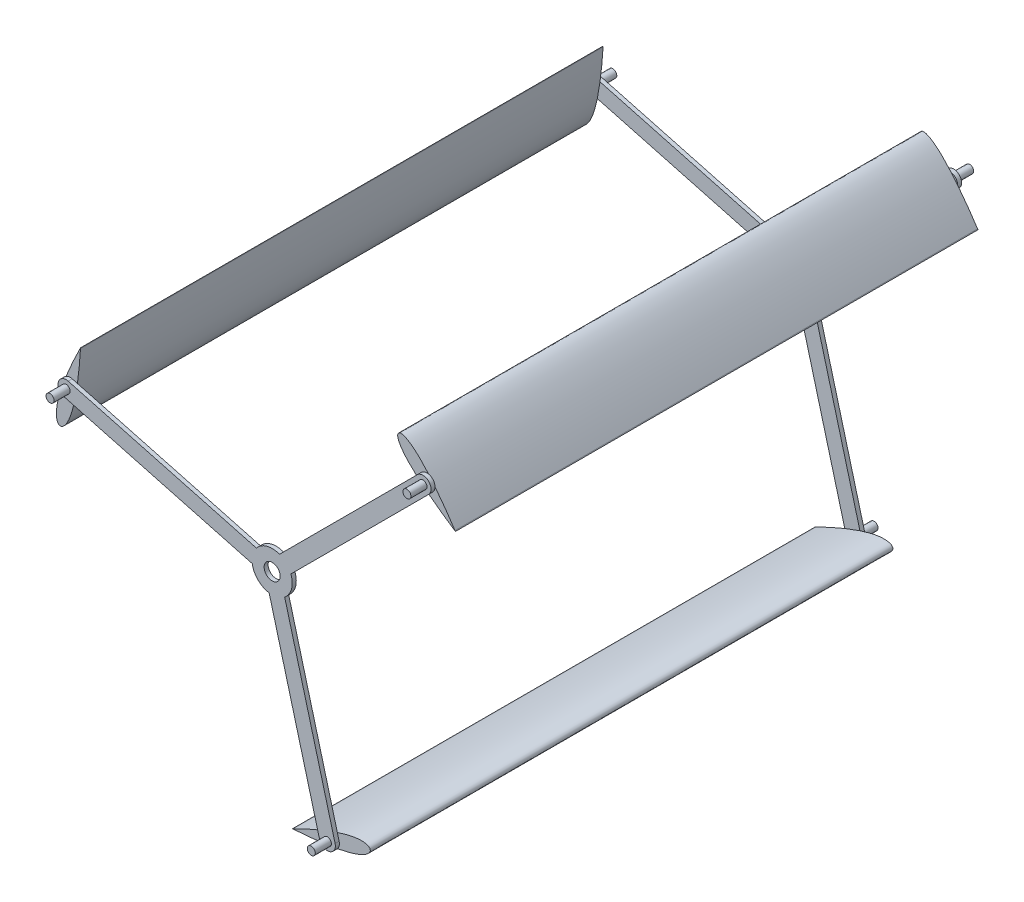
SolidWorks part; units mm, degrees
ref_plane "Front Plane" through (0, 0, 0) normal (0, 0, 1) x (1, 0, 0)
ref_plane "Top Plane" through (0, 0, 0) normal (0, 1, 0) x (1, 0, 0)
ref_plane "Right Plane" through (0, 0, 0) normal (1, 0, 0) x (0, 0, -1)
curve "Curve1"
sketch "Sketch2" plane through (0, 0, 0) normal (0, 0, 1) x (1, 0, 0)
  line L0 (222.4638, 153.0343) -> (222.972, 152.2613)
  line L1 (222.1989, 152.7695) -> (222.972, 152.2613)
  line L2 (222.972, 152.2613) -> (152.2613, 222.972) construction
  line L3 (152.2613, 222.972) -> (159.3324, 230.043) construction
  line L4 (0, 0) -> (270, 0) construction
  line L5 (21.2028, -268.8147) -> (20.3762, -269.23)
  line L6 (21.2997, -269.1765) -> (20.3762, -269.23)
  line L7 (-243.4017, 116.0452) -> (-243.3481, 116.9687)
  line L8 (-243.7635, 116.1421) -> (-243.3481, 116.9687)
  circle A0 centre (0, 0) radius 270 construction
  spline S0 degree 3 poles (21.2997, -269.1765) (22.9826, -269.0788) (26.3445, -268.8838) (33.0486, -268.397) (41.3962, -267.6661) (51.37, -266.5966) (61.2893, -265.33) (71.1454, -263.8269) (80.9209, -262.014) (88.9802, -260.141) (95.338, -258.3231) (100.0555, -256.7548) (104.7113, -254.9199) (108.5033, -253.083) (111.4474, -251.3179) (113.6355, -249.7453) (115.3778, -248.0908) (116.843, -246.0554) (117.487, -243.2093) (115.5062, -241.0664) (113.2197, -240.0364) (110.8835, -239.4746) (108.2023, -239.2068) (104.7701, -239.1502) (100.5676, -239.4554) (95.6182, -240.1942) (90.7485, -241.1948) (84.3336, -242.7994) (76.4175, -245.2069) (67.0452, -248.5247) (57.758, -252.151) (48.5343, -256.0138) (39.3621, -260.0744) (31.7673, -263.6153) (25.718, -266.5457) (22.709, -268.0578) (21.2028, -268.8147) knots 0 0 0 0 0.024604 0.049152 0.098109 0.146905 0.195555 0.244056 0.29241 0.340644 0.364754 0.388906 0.413178 0.437756 0.450305 0.46323 0.477068 0.485036 0.5 0.514964 0.522932 0.53677 0.549695 0.562244 0.586822 0.611094 0.635246 0.659356 0.70759 0.755944 0.804445 0.853095 0.901891 0.950848 0.975396 1 1 1 1
  spline S1 degree 3 poles (222.4638, 153.0343) (221.5378, 154.4429) (219.688, 157.2569) (215.9143, 162.8194) (211.1075, 169.6832) (205.1944, 177.786) (199.1378, 185.7431) (192.9081, 193.5272) (186.4503, 201.0866) (180.7986, 207.1296) (176.0454, 211.7266) (172.3284, 215.028) (168.4114, 218.1426) (164.9246, 220.5081) (161.924, 222.1752) (159.468, 223.2839) (157.164, 223.9655) (154.6688, 224.2167) (151.8819, 223.3513) (151.0166, 220.5645) (151.2678, 218.0693) (151.9494, 215.7652) (153.058, 213.3093) (154.7251, 210.3086) (157.0906, 206.8218) (160.2052, 202.9049) (163.5066, 199.1879) (168.1036, 194.4347) (174.1467, 188.783) (181.7061, 182.3252) (189.4902, 176.0954) (197.4473, 170.0388) (205.55, 164.1257) (212.4139, 159.3189) (217.9764, 155.5453) (220.7904, 153.6954) (222.1989, 152.7695) knots 0 0 0 0 0.024604 0.049152 0.098109 0.146905 0.195555 0.244056 0.29241 0.340644 0.364754 0.388906 0.413178 0.437756 0.450305 0.46323 0.477068 0.485036 0.5 0.514964 0.522932 0.53677 0.549695 0.562244 0.586822 0.611094 0.635246 0.659356 0.70759 0.755944 0.804445 0.853095 0.901891 0.950848 0.975396 1 1 1 1
  spline S2 degree 3 poles (-243.7635, 116.1421) (-244.5204, 114.6359) (-246.0325, 111.627) (-248.9629, 105.5776) (-252.5038, 97.9828) (-256.5644, 88.8106) (-260.4271, 79.5869) (-264.0535, 70.2997) (-267.3712, 60.9274) (-269.7788, 53.0113) (-271.3833, 46.5964) (-272.3839, 41.7267) (-273.1227, 36.7773) (-273.428, 32.5748) (-273.3714, 29.1426) (-273.1035, 26.4614) (-272.5418, 24.1252) (-271.5118, 21.8387) (-269.3689, 19.8579) (-266.5227, 20.5019) (-264.4874, 21.9671) (-262.8329, 23.7094) (-261.2603, 25.8975) (-259.4952, 28.8416) (-257.6583, 32.6336) (-255.8234, 37.2894) (-254.2551, 42.0069) (-252.4372, 48.3647) (-250.5642, 56.424) (-248.7513, 66.1995) (-247.2482, 76.0556) (-245.9816, 85.9749) (-244.9121, 95.9487) (-244.1812, 104.2963) (-243.6943, 111.0005) (-243.4993, 114.3623) (-243.4017, 116.0452) knots 0 0 0 0 0.024604 0.049152 0.098109 0.146905 0.195555 0.244056 0.29241 0.340644 0.364754 0.388906 0.413178 0.437756 0.450305 0.46323 0.477068 0.485036 0.5 0.514964 0.522932 0.53677 0.549695 0.562244 0.586822 0.611094 0.635246 0.659356 0.70759 0.755944 0.804445 0.853095 0.901891 0.950848 0.975396 1 1 1 1
  point P17 (0, 0)
  dimension "D3" = 540
  dimension "D1" = 100
  dimension "D2" = 10
  dimension "D4" = 45
  dimension "D5" = 3
extrude "Boss-Extrude1" add sketch "Sketch2" along normal blind 650
ref_plane "Plane2" through (0, 0, 325) normal (0, 0, -1) x (-1, 0, 0)
sketch "Sketch5" plane through (0, 0, 325) normal (0, 0, -1) x (-1, 0, 0)
  line L0 (-222.972, 152.2613) -> (-152.2613, 222.972) construction
  circle A0 centre (-187.6166, 187.6166) radius 5
  circle A1 centre (256.2891, 68.6725) radius 5
  circle A2 centre (-68.6725, -256.2891) radius 5
  spline S0 degree 3 poles (-222.4638, 153.0343) (-221.5378, 154.4429) (-219.688, 157.2569) (-215.9143, 162.8194) (-211.1075, 169.6832) (-205.1944, 177.786) (-199.1378, 185.7431) (-192.9081, 193.5272) (-186.4503, 201.0866) (-180.7986, 207.1296) (-176.0454, 211.7266) (-172.3284, 215.028) (-168.4114, 218.1426) (-164.9246, 220.5081) (-161.924, 222.1752) (-159.468, 223.2839) (-157.164, 223.9655) (-154.6688, 224.2167) (-151.8819, 223.3513) (-151.0166, 220.5645) (-151.2678, 218.0693) (-151.9494, 215.7652) (-153.058, 213.3093) (-154.7251, 210.3086) (-157.0906, 206.8218) (-160.2052, 202.9049) (-163.5066, 199.1879) (-168.1036, 194.4347) (-174.1467, 188.783) (-181.7061, 182.3252) (-189.4902, 176.0954) (-197.4473, 170.0388) (-205.55, 164.1257) (-212.4139, 159.3189) (-217.9764, 155.5453) (-220.7904, 153.6954) (-222.1989, 152.7695) knots 0 0 0 0 0.024604 0.049152 0.098109 0.146905 0.195555 0.244056 0.29241 0.340644 0.364754 0.388906 0.413178 0.437756 0.450305 0.46323 0.477068 0.485036 0.5 0.514964 0.522932 0.53677 0.549695 0.562244 0.586822 0.611094 0.635246 0.659356 0.70759 0.755944 0.804445 0.853095 0.901891 0.950848 0.975396 1 1 1 1 construction
  point P13 (0, 0)
  dimension "D1" = 10
  dimension "D2" = 3
extrude "Boss-Extrude3" add sketch "Sketch5" along normal mid plane 700
sketch "Sketch3" plane through (0, 0, 0) normal (0, 0, -1) x (-1, 0, 0)
  line L0 (243.3481, 116.9687) -> (269.23, 20.3762) construction
  line L1 (0, 0) -> (256.2891, 68.6725) construction
  line L2 (24.7203, -3.729) -> (258.8773, 59.0132)
  line L3 (19.544, 15.5895) -> (253.7009, 78.3317)
  line L5 (-2.5882, 9.6593) -> (253.7009, 78.3317) construction
  line L6 (2.5882, -9.6593) -> (258.8773, 59.0132) construction
  line L7 (3.729, -24.7203) -> (-59.0132, -258.8773)
  line L9 (-15.5895, -19.544) -> (-78.3317, -253.7009)
  line L10 (-23.2729, 9.1308) -> (-194.6877, 180.5456)
  line L12 (-9.1308, 23.2729) -> (-180.5456, 194.6877)
  circle A0 centre (0, 0) radius 10
  arc A1 (19.544, 15.5895) -> (-9.1308, 23.2729) centre (0, 0) ccw
  arc A2 (-23.2729, 9.1308) -> (-15.5895, -19.544) centre (0, 0) ccw
  arc A3 (3.729, -24.7203) -> (24.7203, -3.729) centre (0, 0) ccw
  arc A4 (253.7009, 78.3317) -> (258.8773, 59.0132) centre (256.2891, 68.6725) cw
  arc A5 (-180.5456, 194.6877) -> (-194.6877, 180.5456) centre (-187.6166, 187.6166) ccw
  arc A6 (-59.0132, -258.8773) -> (-78.3317, -253.7009) centre (-68.6725, -256.2891) cw
  spline S0 degree 3 poles (243.7635, 116.1421) (244.5204, 114.6359) (246.0325, 111.627) (248.9629, 105.5776) (252.5038, 97.9828) (256.5644, 88.8106) (260.4271, 79.5869) (264.0535, 70.2997) (267.3712, 60.9274) (269.7788, 53.0113) (271.3833, 46.5964) (272.3839, 41.7267) (273.1227, 36.7773) (273.428, 32.5748) (273.3714, 29.1426) (273.1035, 26.4614) (272.5418, 24.1252) (271.5118, 21.8387) (269.3689, 19.8579) (266.5227, 20.5019) (264.4874, 21.9671) (262.8329, 23.7094) (261.2603, 25.8975) (259.4952, 28.8416) (257.6583, 32.6336) (255.8234, 37.2894) (254.2551, 42.0069) (252.4372, 48.3647) (250.5642, 56.424) (248.7513, 66.1995) (247.2482, 76.0556) (245.9816, 85.9749) (244.9121, 95.9487) (244.1812, 104.2963) (243.6943, 111.0005) (243.4993, 114.3623) (243.4017, 116.0452) knots 0 0 0 0 0.024604 0.049152 0.098109 0.146905 0.195555 0.244056 0.29241 0.340644 0.364754 0.388906 0.413178 0.437756 0.450305 0.46323 0.477068 0.485036 0.5 0.514964 0.522932 0.53677 0.549695 0.562244 0.586822 0.611094 0.635246 0.659356 0.70759 0.755944 0.804445 0.853095 0.901891 0.950848 0.975396 1 1 1 1 construction
  point P25 (0, 0)
  dimension "D3" = 20
  dimension "D4" = 50
  dimension "D1" = 10
  dimension "D2" = 10
  dimension "D5" = 3
extrude "Boss-Extrude2" add sketch "Sketch3" along normal blind 5
ref_plane "Plane1" through (0, 0, 325) normal (0, 0, -1) x (-1, 0, 0)
mirror "Mirror1" about plane through (0, 0, 325) normal (0, 0, -1) of "Boss-Extrude2"
